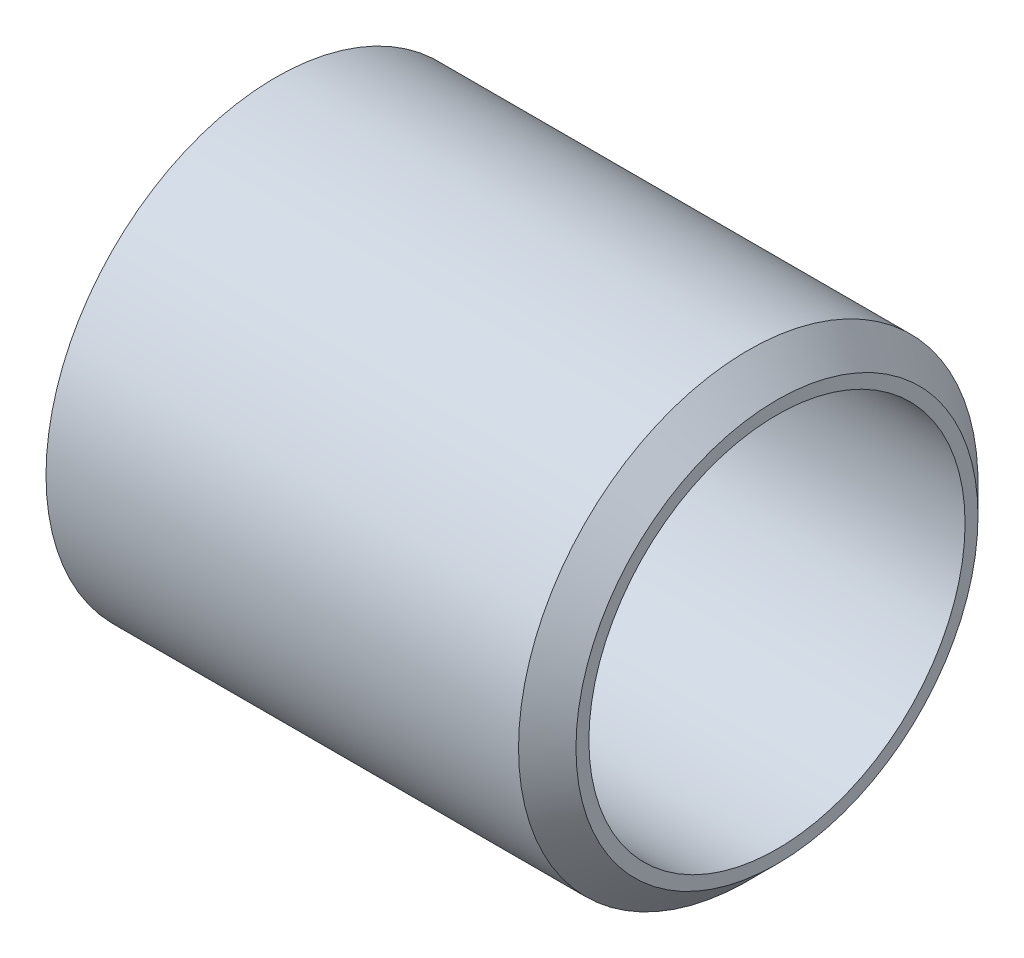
SolidWorks part; units mm, degrees
ref_plane "Plane1" through (0, 0, 0) normal (0, 0, 1) x (1, 0, 0)
ref_plane "Plane2" through (0, 0, 0) normal (0, 1, 0) x (1, 0, 0)
ref_plane "Plane3" through (0, 0, 0) normal (1, 0, 0) x (0, 0, -1)
sketch "Sketch1" plane through (0, 0, 0) normal (0, 0, 1) x (1, 0, 0)
  line L0 (0, 0) -> (76.2, 0) construction
  line L1 (0, 31.7691) -> (0, 34.925)
  line L4 (0, 34.925) -> (71.8344, 34.925)
  line L5 (71.8344, 34.925) -> (76.2, 30.5594)
  line L6 (76.2, 30.5594) -> (76.2, 28.594)
  line L7 (76.2, 28.594) -> (3.175, 28.5941)
  line L8 (71.8344, -34.925) -> (76.2, -30.5594) construction
  line L9 (76.2, -28.594) -> (0, -28.5941) construction
  line L10 (0, -34.925) -> (71.8344, -34.925) construction
  arc A1 (0, 31.7691) -> (3.175, 28.5941) centre (3.175, 31.7691) ccw
  point P20 (0, 28.5941)
  dimension "Head_radius" = 3.175
  dimension "D1" = 61.1187
  dimension "Hole_dia" = 57.1881
  dimension "Body_dia" = 69.85
  dimension "D2" = 45
  dimension "Body_len" = 76.2
revolve "BaseBody" add sketch "Sketch1" angle 360 about L0
equation "\"D1@Sketch1\" = \"Body_dia@Sketch1\" * .875"
